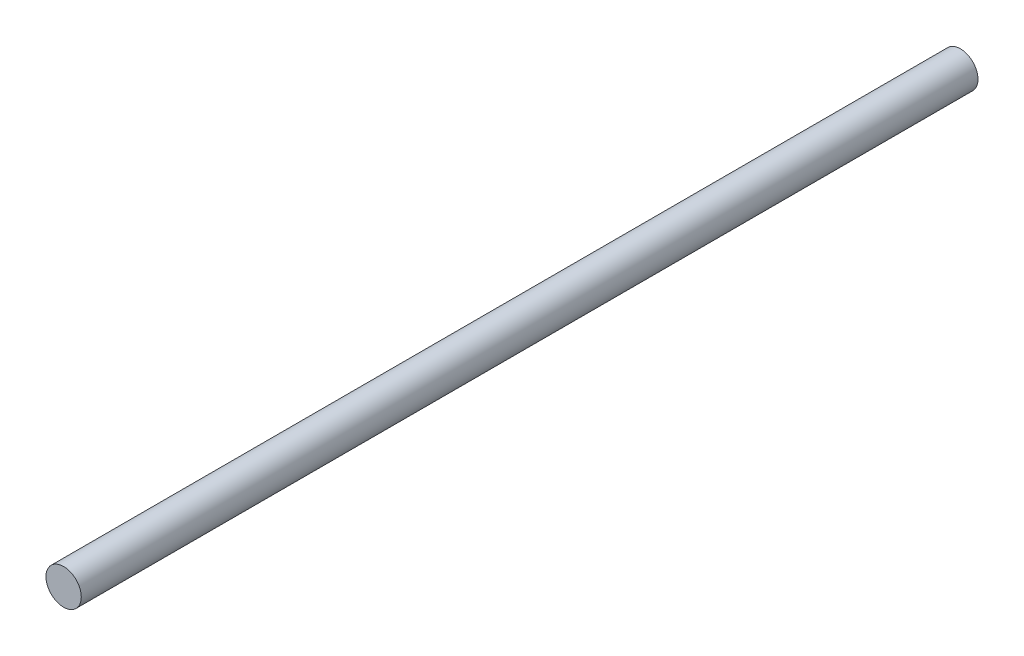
SolidWorks part; units mm, degrees
ref_plane "Front Plane" through (0, 0, 0) normal (0, 0, 1) x (1, 0, 0)
ref_plane "Top Plane" through (0, 0, 0) normal (0, 1, 0) x (1, 0, 0)
ref_plane "Right Plane" through (0, 0, 0) normal (1, 0, 0) x (0, 0, -1)
sketch "Sketch2" plane through (0, 0, 0) normal (0, 0, 1) x (1, 0, 0)
  circle A0 centre (0, 0) radius 5
  dimension "D1" = 10
extrude "Boss-Extrude1" add sketch "Sketch2" along normal blind 254
